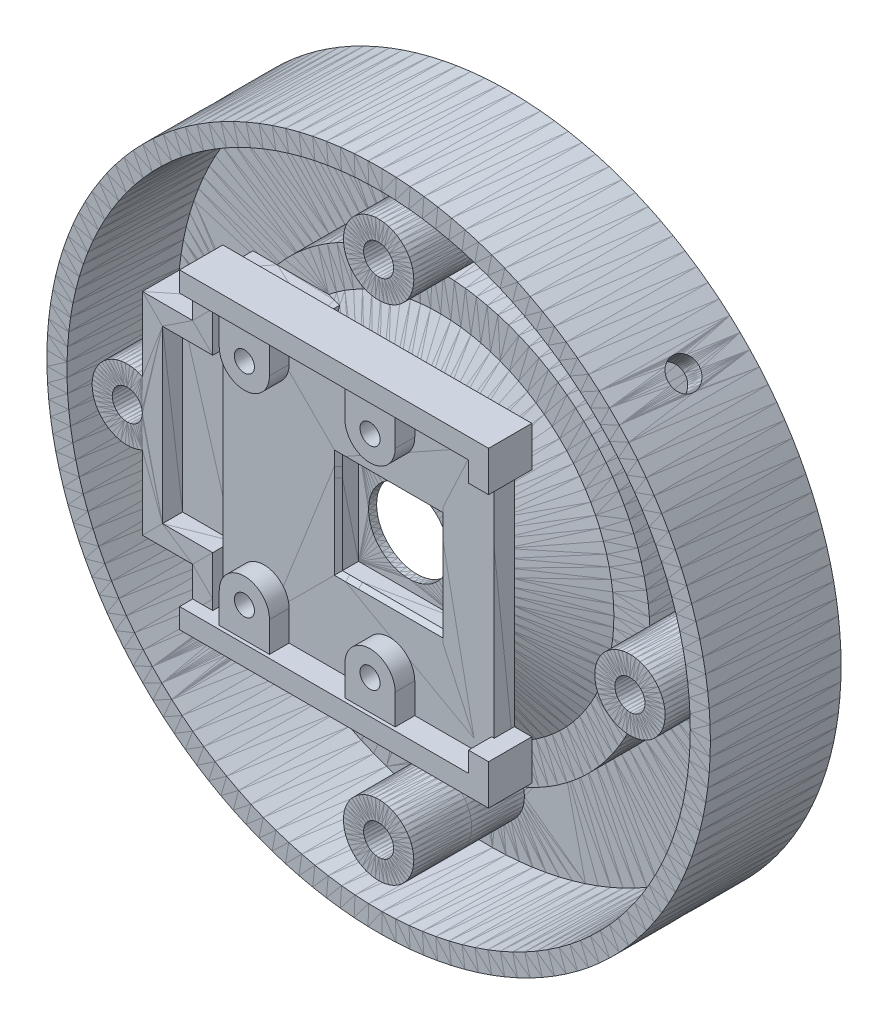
SolidWorks part; units mm, degrees
ref_plane "Front Plane" through (0, 0, 0) normal (0, 0, 1) x (1, 0, 0)
ref_plane "Top Plane" through (0, 0, 0) normal (0, 1, 0) x (1, 0, 0)
ref_plane "Right Plane" through (0, 0, 0) normal (1, 0, 0) x (0, 0, -1)
imported_body "Imported1"
sketch "Sketch1" plane through (0, 0, 0) normal (0, 0, -1) x (-1, 0, 0)
  line L0 (-55.6205, -32.4642) -> (-67.3844, 32.4714) construction
  line L1 (-54.936, -32.3402) -> (-56.3051, -32.5883) construction
  circle A0 centre (-61.5025, 0.0036) radius 13.8116
sketch "Sketch2" plane through (0, 0, 12) normal (0, 0, 1) x (1, 0, 0)
  line L1 (76.9293, 19.09) -> (45.0018, 19.09)
  line L2 (76.9293, 19.09) -> (76.9293, -19.2378)
  line L3 (76.9293, -19.2378) -> (45.0018, -19.2378)
  line L4 (45.0018, 19.09) -> (45.0018, -19.2378)
  line L5 (45.0018, 12.5) -> (45.0018, 8.5) construction
extrude "Cut-Extrude1" cut sketch "Sketch2" along normal blind 10
sketch "Sketch4" plane through (0, 0, 12) normal (0, 0, 1) x (1, 0, 0)
  line L0 (43.0018, -10.5) -> (43.0018, -14.5) construction
  line L1 (43.0018, -13.4943) -> (72.0018, -13.4943)
  line L2 (43.0018, -13.4943) -> (43.0018, -15.4943)
  line L3 (43.0018, -15.4943) -> (72.0018, -15.4943)
  line L4 (72.0018, -13.4943) -> (72.0018, -15.4943)
  line L7 (72.0018, 4.8333) -> (72.0018, -14.5) construction
  line L8 (60.682, -12.4943) -> (50.015, -12.4943) construction
  line L9 (43.0018, 15.5057) -> (72.0018, 15.5057)
  line L10 (43.0018, 15.5057) -> (43.0018, 13.5057)
  line L11 (43.0018, 13.5057) -> (72.0018, 13.5057)
  line L12 (72.0018, 15.5057) -> (72.0018, 13.5057)
  line L13 (62.515, 12.5057) -> (68.9605, 12.5057) construction
  dimension "D1" = 1
  dimension "D2" = 1
  dimension "D3" = 2
extrude "Boss-Extrude1" add sketch "Sketch4" along normal blind 2.3 and the other way up to vertex
sketch "Sketch5" plane through (0, 0, 12) normal (0, 0, 1) x (1, 0, 0)
  line L1 (71.7389, -15.4943) -> (73.7389, -15.4943)
  line L2 (71.7389, -15.4943) -> (71.7389, -11.4943)
  line L3 (71.7389, -11.4943) -> (73.7389, -11.4943)
  line L4 (73.7389, -15.4943) -> (73.7389, -11.4943)
  line L5 (43.0018, -15.4943) -> (72.0018, -15.4943) construction
  line L6 (70.9389, -11.0436) -> (70.9389, -6.6498) construction
  line L7 (72.0018, 15.5057) -> (71.7389, -15.4943) construction
  line L8 (71.8704, 0.0057) -> (106.1454, 0.0057) construction
  line L10 (73.7389, 15.5057) -> (73.7389, 11.5057)
  line L11 (71.7389, 11.5057) -> (73.7389, 11.5057)
  line L12 (71.7389, 15.5057) -> (71.7389, 11.5057)
  line L13 (71.7389, 15.5057) -> (73.7389, 15.5057)
  dimension "D1" = 0.8
  dimension "D2" = 2
  dimension "D3" = 4
extrude "Boss-Extrude2" add sketch "Sketch5" against normal up to vertex and the other way up to surface
sketch "Sketch8" plane through (0, 0, 12) normal (0, 0, 1) x (1, 0, 0)
  line L0 (71.7389, -13.4943) -> (45.0018, -13.4943) construction
  line L1 (45.0018, 13.5057) -> (50.6678, 13.5057)
  line L2 (45.0018, 13.5057) -> (45.0018, -13.4943)
  line L3 (45.0018, -13.4943) -> (50.6678, -13.4943)
  line L4 (50.6678, 13.5057) -> (50.6678, -13.4943)
  point P4 (54.4873, -11.6022)
extrude "Boss-Extrude3" add sketch "Sketch8" against normal up to surface (3 mm away)
sketch "Sketch10" plane through (0, 0, 12) normal (0, 0, 1) x (1, 0, 0)
  line L0 (51.5985, -10.4943) -> (51.5985, -14.5008)
  line L1 (51.5985, -14.5008) -> (46.5985, -14.5008)
  line L2 (46.5985, -14.5008) -> (46.5985, -10.4943)
  line L3 (64.0985, -10.4943) -> (64.0985, -14.7322)
  line L4 (64.0985, -14.7322) -> (59.0985, -14.7322)
  line L5 (59.0985, -14.7322) -> (59.0985, -10.4943)
  line L6 (64.0985, 10.5057) -> (64.0985, 14.5749)
  line L7 (64.0985, 14.5749) -> (59.0985, 14.5749)
  line L8 (59.0985, 14.5749) -> (59.0985, 10.5057)
  line L9 (51.5985, 10.5057) -> (51.5985, 14.6335)
  line L10 (51.5985, 14.6335) -> (46.5985, 14.6335)
  line L11 (46.5985, 14.6335) -> (46.5985, 10.5057)
  circle A0 centre (49.0985, -10.4943) radius 1
  arc A1 (51.5985, -10.4943) -> (46.5985, -10.4943) centre (49.0985, -10.4943) ccw
  circle A2 centre (49.0985, -10.4943) radius 2.5 construction
  circle A3 centre (61.5985, -10.4943) radius 1
  arc A4 (64.0985, -10.4943) -> (59.0985, -10.4943) centre (61.5985, -10.4943) ccw
  circle A5 centre (61.5985, -10.4943) radius 2.5 construction
  circle A6 centre (61.5985, 10.5057) radius 1
  arc A7 (59.0985, 10.5057) -> (64.0985, 10.5057) centre (61.5985, 10.5057) ccw
  circle A8 centre (61.5985, 10.5057) radius 2.5 construction
  circle A9 centre (49.0985, 10.5057) radius 1
  arc A10 (46.5985, 10.5057) -> (51.5985, 10.5057) centre (49.0985, 10.5057) ccw
  circle A11 centre (49.0985, 10.5057) radius 2.5 construction
  point P35 (51.5985, 14.6335)
  dimension "D1" = 2
  dimension "D3" = 2
  dimension "D5" = 2
  dimension "D7" = 2
  dimension "D4" = 1.5
  dimension "D2" = 1.5
  dimension "D6" = 1.5
  dimension "D8" = 1.5
extrude "Boss-Extrude4" add sketch "Sketch10" along normal up to surface (1.95 mm away)
chamfer "Chamfer1" distance 0.4 angle 45 4 edges at (61.5018, 5, 12) (66.5018, 0, 12) (61.5018, -5, 12) (56.5018, 0, 12)
sketch "Sketch11" plane through (0, 0, 12) normal (0, 0, 1) x (1, 0, 0)
  circle A0 centre (61.5985, 10.5057) radius 1 construction
  circle A1 centre (49.0985, 10.5057) radius 1 construction
  circle A2 centre (49.0985, -10.4943) radius 1 construction
  circle A3 centre (61.5985, -10.4943) radius 1 construction
  circle A4 centre (61.5985, 10.5057) radius 1
  circle A5 centre (49.0985, 10.5057) radius 1
  circle A6 centre (49.0985, -10.4943) radius 1
  circle A7 centre (61.5985, -10.4943) radius 1
extrude "Cut-Extrude3" cut sketch "Sketch11" against normal blind 0.5
